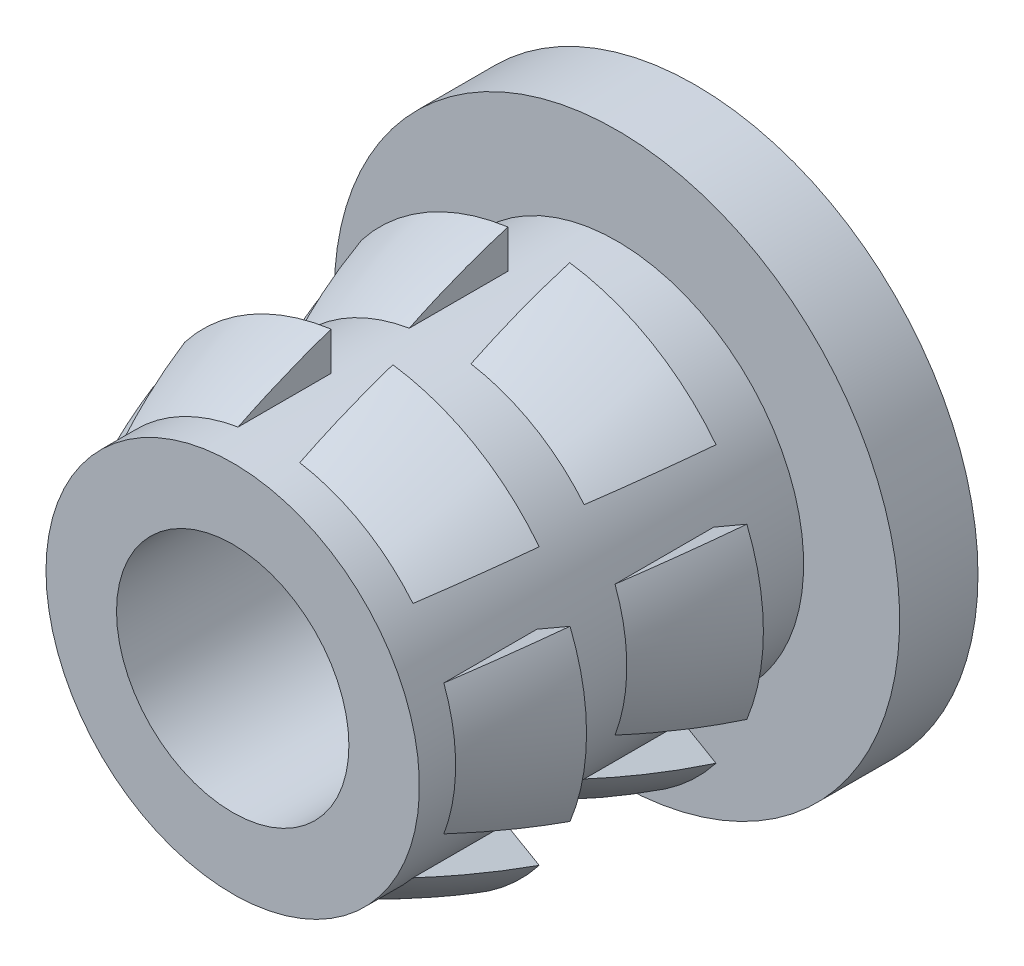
SolidWorks part; units mm, degrees
other "<Flanged Insert 4-40 S1>-<Move Face2>"
ref_plane "Front Plane" through (0, 0, 0) normal (0, 0, 1) x (1, 0, 0)
ref_plane "Top Plane" through (0, 0, 0) normal (0, 1, 0) x (1, 0, 0)
ref_plane "Right Plane" through (0, 0, 0) normal (1, 0, 0) x (0, 0, -1)
inserted part "Flanged Insert 4-40 S1"
